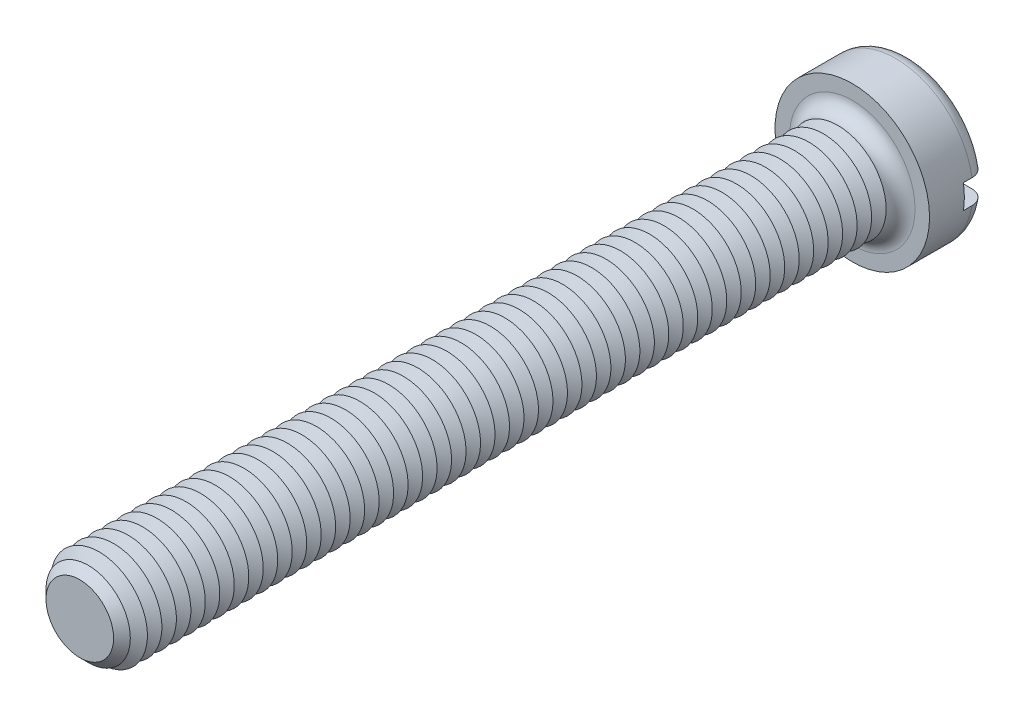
SolidWorks part; units mm, degrees
ref_plane "Front Plane" through (0, 0, 0) normal (0, 0, 1) x (1, 0, 0)
ref_plane "Top Plane" through (0, 0, 0) normal (0, 1, 0) x (1, 0, 0)
ref_plane "Right Plane" through (0, 0, 0) normal (1, 0, 0) x (0, 0, -1)
sketch "Sketch3" plane through (0, 0, 0) normal (0, 0, 1) x (1, 0, 0)
  circle A0 centre (0, 0) radius 8
  dimension "D1" = 16
extrude "Boss-Extrude2" add sketch "Sketch3" against normal blind 6
sketch "Sketch4" plane through (0, 0, 0) normal (0, 0, 1) x (1, 0, 0)
  circle A0 centre (0, 0) radius 5
  dimension "D1" = 10
extrude "Boss-Extrude3" add sketch "Sketch4" along normal blind 80
fillet "Fillet1" radius 1.5 2 edges at (8, 0, -6) (5, 0, 0)
chamfer "Chamfer1" distance 1.5 angle 45 1 edges at (5, 0, 80)
sketch "Sketch5" plane through (0, 0, 0) normal (1, 0, 0) x (0, 0, -1)
  line L0 (1.6944, 0) -> (-7.6738, 0) construction
sketch "Sketch6" plane through (0, 0, 0) normal (1, 0, 0) x (0, 0, -1)
  line L0 (-1.5, 5) -> (-2.25, 3.701)
  line L1 (-2.25, 3.701) -> (-3, 5)
  line L2 (-1.5, 5) -> (-78.5, 5) construction
  line L3 (-3, 5) -> (-1.5, 5)
  dimension "D1" = 1.5
revolve "Cut-Revolve1" cut sketch "Sketch6" angle 360 about L0
pattern_linear "LPattern1" count 52 spacing 1.5 along (0, 0, 1) of "Cut-Revolve1"
sketch "Sketch8" plane through (0, 0, -6) normal (0, 0, -1) x (-1, 0, 0)
  line L1 (8, -1.25) -> (-8, -1.25)
  line L2 (8, -1.25) -> (8, 1.25)
  line L3 (8, 1.25) -> (-8, 1.25)
  line L4 (-8, -1.25) -> (-8, 1.25)
  line L5 (8, -1.25) -> (-8, 1.25) construction
  line L6 (8, 1.25) -> (-8, -1.25) construction
  point P0 (0, 0)
  dimension "D1" = 16
  dimension "D2" = 2.5
extrude "Cut-Extrude1" cut sketch "Sketch8" against normal blind 2.4
